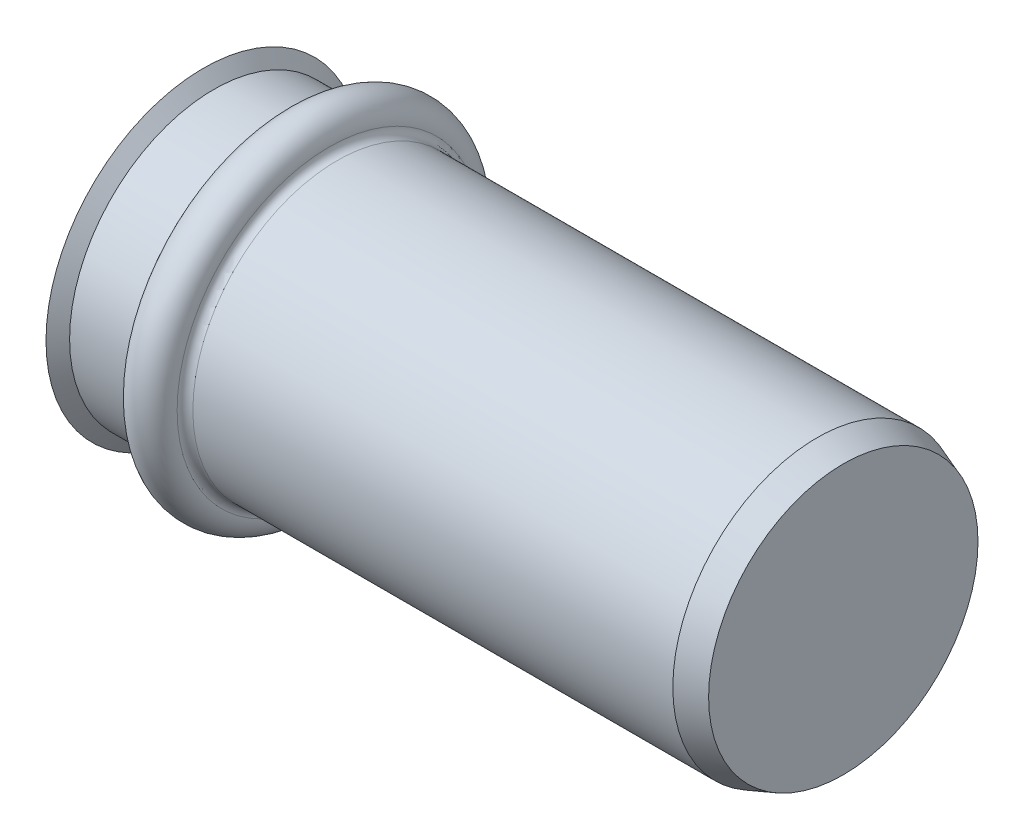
SolidWorks part; units mm, degrees
other "1"
ref_plane "Ebene vorne" through (0, 0, 0) normal (0, 0, 1) x (1, 0, 0)
ref_plane "Ebene oben" through (0, 0, 0) normal (0, 1, 0) x (1, 0, 0)
ref_plane "Ebene rechts" through (0, 0, 0) normal (1, 0, 0) x (0, 0, -1)
imported_body "Importiert1"
other "Fläche löschen1"
